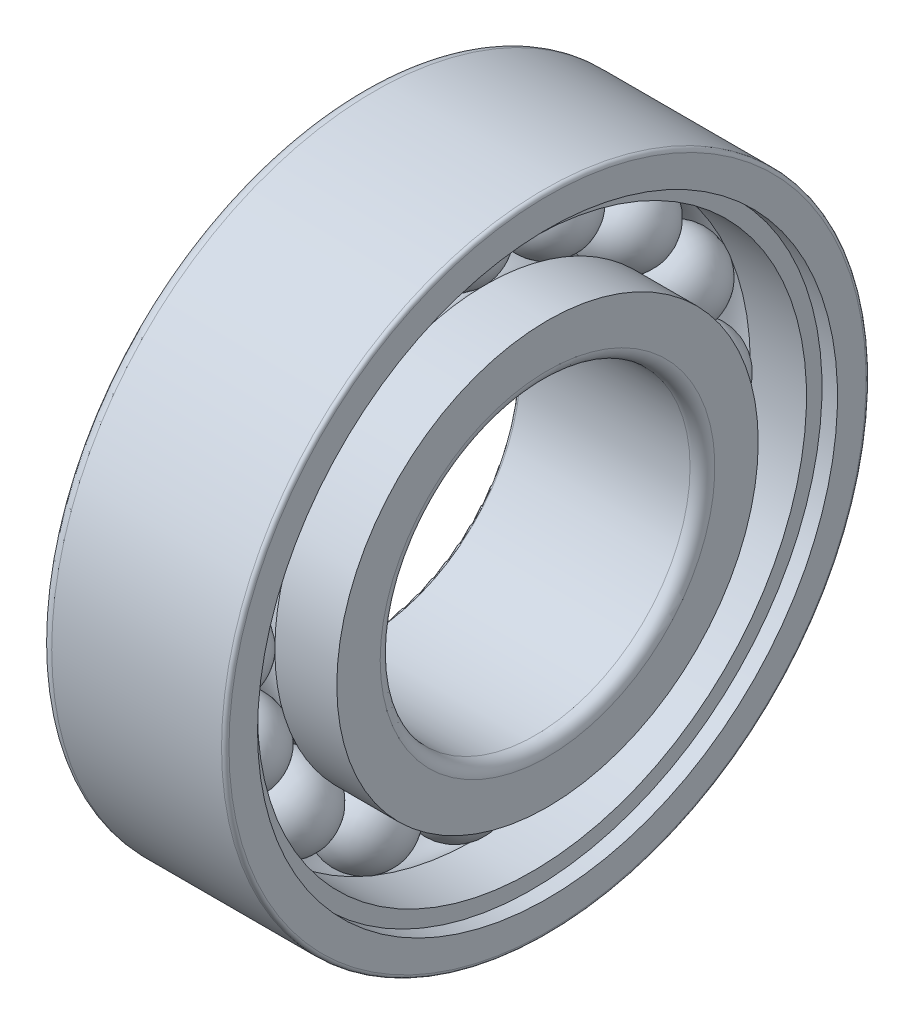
SolidWorks part; units mm, degrees
ref_plane "Front" through (0, 0, 0) normal (0, 0, 1) x (1, 0, 0)
ref_plane "Top" through (0, 0, 0) normal (0, 1, 0) x (1, 0, 0)
ref_plane "Right" through (0, 0, 0) normal (1, 0, 0) x (0, 0, -1)
sketch "Sketch1" plane through (0, 0, 0) normal (0, 0, 1) x (1, 0, 0)
  line L0 (-3.0919, 0) -> (2.899, 0) construction
  line L1 (-3.0919, 19.25) -> (2.899, 19.25) construction
  line L2 (-3.375, 19.25) -> (3.375, 19.25)
  arc A0 (-3.375, 19.25) -> (3.375, 19.25) centre (0, 19.25) ccw
revolve "Revolve1" add sketch "Sketch1" angle 360 about L1
sketch "Sketch2" plane through (0, 0, 0) normal (0, 0, 1) x (1, 0, 0)
  line L0 (-7.5, 17) -> (-2.5021, 17)
  line L1 (7.5, 17) -> (7.5, 12.5)
  line L2 (7.5, 12.5) -> (-7.5, 12.5)
  line L3 (-7.5, 12.5) -> (-7.5, 17)
  line L4 (-2.9924, 0) -> (3.9982, 0) construction
  line L5 (-1.8743, 19.25) -> (3.1755, 19.25) construction
  line L7 (2.5021, 17) -> (7.5, 17)
  line L8 (-7.5, 6.2861) -> (-7.5, 1.454) construction
  arc A0 (-2.5021, 17) -> (2.5021, 17) centre (0, 19.25) ccw
revolve "Revolve2" add sketch "Sketch2" angle 360 about L4
sketch "Sketch3" plane through (0, 0, 0) normal (0, 0, 1) x (1, 0, 0)
  line L0 (-7.5, 21.5) -> (-7.5, 26)
  line L1 (-7.5, 26) -> (7.5, 26)
  line L2 (7.5, 26) -> (7.5, 23.395)
  line L3 (6.25, 22.145) -> (1.7153, 22.145)
  line L4 (-2.9924, 0) -> (3.4329, 0) construction
  line L6 (-1.7375, 19.25) -> (2.2712, 19.25) construction
  line L7 (-2.5021, 21.5) -> (-7.5, 21.5)
  line L8 (6.25, 22.145) -> (6.25, 23.395)
  line L9 (6.25, 23.395) -> (7.5, 23.395)
  arc A0 (1.7153, 22.145) -> (-2.5021, 21.5) centre (0, 19.25) ccw
revolve "Revolve3" add sketch "Sketch3" angle 360 about L4
pattern_circular "Circular-Pattern1" count 16 over 360 about axis through (0, 0, 0) along (1, 0, 0) of "Revolve1"
fillet "Fillet1" radius 1 2 edges at (7.5, 0, 12.5) (-7.5, 0, 26)
fillet "Fillet2" radius 0.3 2 edges at (7.5, 0, 26) (-7.5, 0, 12.5)
equation "\"R@Sketch1\" =  ( \"DD@Sketch3\" - \"d@Sketch2\" )  / 8"
equation "\"D1@Sketch1\"=(\"d@Sketch2\"+\"DD@Sketch3\")/4"
equation "\"D1@Sketch2\"=(\"d@Sketch2\"+\"DD@Sketch3\")/4"
equation "\"D3@Sketch2\" =  \"d@Sketch2\"+  ( \"DD@Sketch3\" - \"d@Sketch2\" )  /3"
equation "\"D2@Sketch2\" =  ( \"DD@Sketch3\" - \"d@Sketch2\" )  / 8 - 0.01"
equation "\"D6@Sketch2\" = \"B@Sketch2\" / 2"
equation "\"B@Sketch3\" = \"B@Sketch2\""
equation "\"D2@Sketch3\" = \"B@Sketch3\" / 2"
equation "\"D1@Sketch3\"=(\"d@Sketch2\"+\"DD@Sketch3\")/4"
equation "\"D3@Sketch3\" = (  \"DD@Sketch3\" -  (\"DD@Sketch3\" - \"d@Sketch2\"  )  / 3 )  * 1.03"
equation "\"D5@Sketch3\" = \"DD@Sketch3\" -  (  \"DD@Sketch3\" - \"d@Sketch2\")  / 3"
equation "\"D6@Sketch3\" = \"d@Sketch2\" / 20"
equation "\"D7@Sketch3\"=\"D6@Sketch3\""
equation "\"D4@Sketch3\"=(\"DD@Sketch3\"-\"d@Sketch2\")/8-0.01"
equation "\"m@Circular-Pattern1\" = int( 3.14159265 / atn(\"R@Sketch1\" / sqr((\"d@Sketch2\"+\"DD@Sketch3\")/4 * (\"d@Sketch2\"+\"DD@Sketch3\")/4 - \"R@Sketch1\" *  \"R@Sketch1\")))-1"
